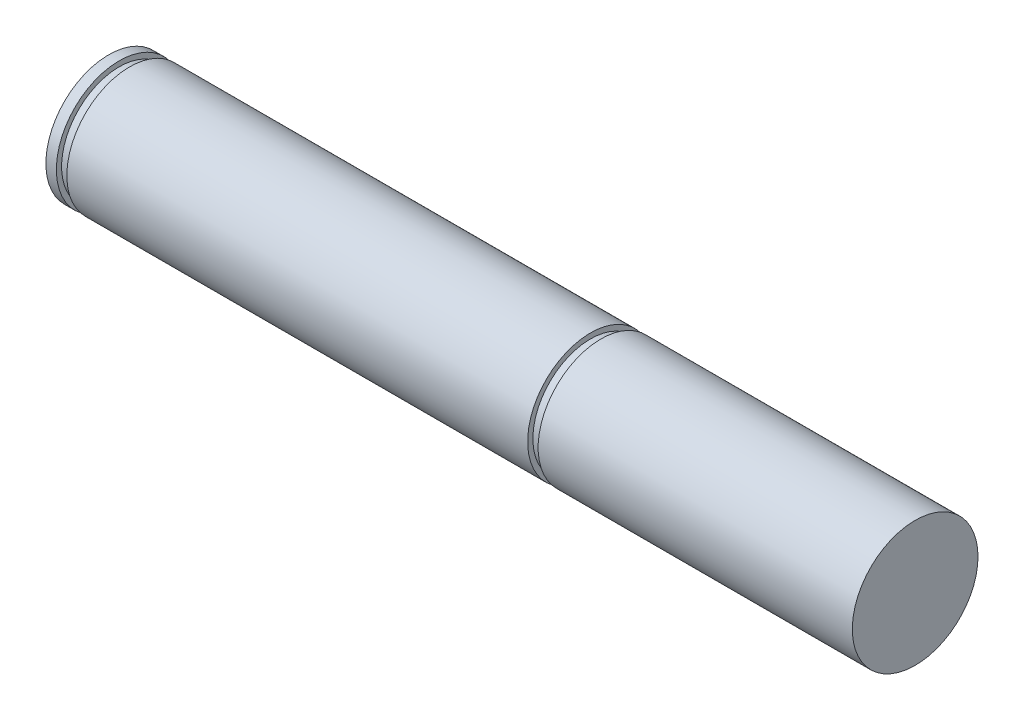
SolidWorks part; units mm, degrees
ref_plane "Спереди" through (0, 0, 0) normal (0, 0, 1) x (1, 0, 0)
ref_plane "Сверху" through (0, 0, 0) normal (0, 1, 0) x (1, 0, 0)
ref_plane "Справа" through (0, 0, 0) normal (1, 0, 0) x (0, 0, -1)
sketch "Эскиз1" plane through (0, 0, 0) normal (1, 0, 0) x (0, 0, -1)
  circle A0 centre (0, 0) radius 6
  dimension "D1" = 12
extrude "Бобышка-Вытянуть1" add sketch "Эскиз1" along normal blind 1
sketch "Эскиз3" plane through (1, 0, 0) normal (1, 0, 0) x (0, 0, -1)
  circle A0 centre (0, 0) radius 5.5
  dimension "D1" = 11
extrude "Бобышка-Вытянуть2" add sketch "Эскиз3" along normal blind 1
sketch "Эскиз4" plane through (2, 0, 0) normal (1, 0, 0) x (0, 0, -1)
  circle A0 centre (0, 0) radius 6
  dimension "D1" = 12
extrude "Бобышка-Вытянуть3" add sketch "Эскиз4" along normal blind 44
sketch "Эскиз5" plane through (46, 0, 0) normal (1, 0, 0) x (0, 0, -1)
  circle A0 centre (0, 0) radius 5.5
  dimension "D1" = 11
extrude "Бобышка-Вытянуть4" add sketch "Эскиз5" along normal blind 1
sketch "Эскиз6" plane through (47, 0, 0) normal (1, 0, 0) x (0, 0, -1)
  circle A0 centre (0, 0) radius 6
extrude "Бобышка-Вытянуть5" add sketch "Эскиз6" along normal blind 30
